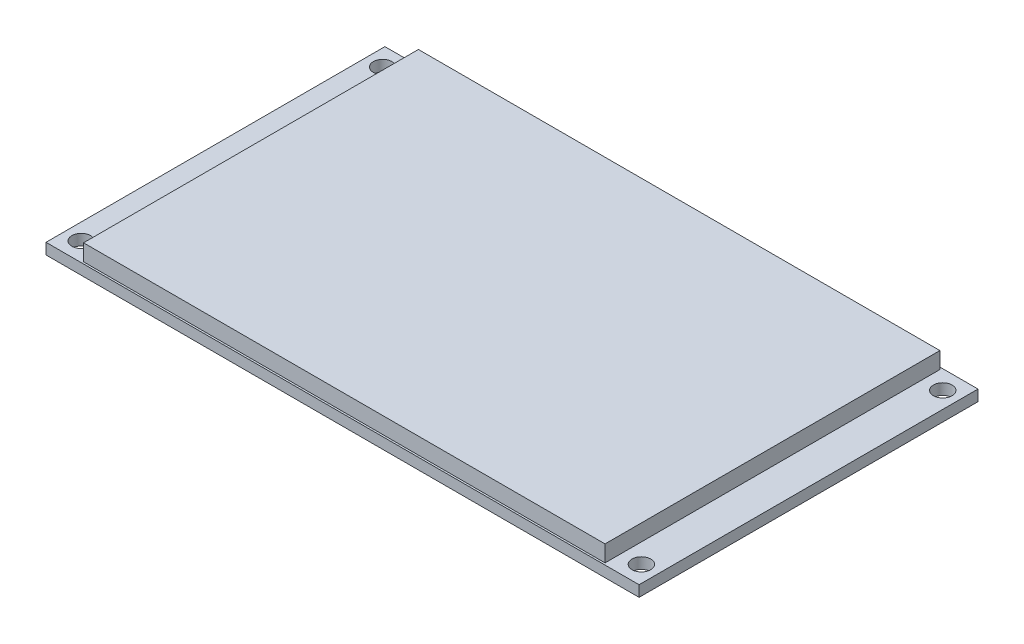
SolidWorks part; units mm, degrees
ref_plane "Piano frontale" through (0, 0, 0) normal (0, 0, 1) x (1, 0, 0)
ref_plane "Piano superiore" through (0, 0, 0) normal (0, 1, 0) x (1, 0, 0)
ref_plane "Piano destro" through (0, 0, 0) normal (1, 0, 0) x (0, 0, -1)
sketch "Schizzo2" plane through (0, 0, 0) normal (0, 1, 0) x (1, 0, 0)
  line L1 (-54.02, 30.87) -> (54.02, 30.87)
  line L2 (-54.02, 30.87) -> (-54.02, -30.87)
  line L3 (-54.02, -30.87) -> (54.02, -30.87)
  line L4 (54.02, 30.87) -> (54.02, -30.87)
  line L5 (-54.02, 30.87) -> (54.02, -30.87) construction
  line L6 (-54.02, -30.87) -> (54.02, 30.87) construction
  point P0 (0, 0)
  dimension "D1" = 108.04
  dimension "D2" = 61.74
extrude "Estrusione-Estrusione1" add sketch "Schizzo2" along normal blind 2
sketch "Schizzo3" plane through (0, 2, 0) normal (0, 1, 0) x (1, 0, 0)
  line L0 (54.02, -30.87) -> (54.02, 30.87) construction
  line L1 (-47.52, 30.47) -> (47.48, 30.47)
  line L2 (-47.52, 30.47) -> (-47.52, -30.53)
  line L3 (-47.52, -30.53) -> (47.48, -30.53)
  line L4 (47.48, 30.47) -> (47.48, -30.53)
  line L5 (-47.52, 30.47) -> (47.48, -30.53) construction
  line L6 (-47.52, -30.53) -> (47.48, 30.47) construction
  line L7 (54.02, 30.87) -> (-54.02, 30.87) construction
  point P0 (-0.02, -0.03)
  dimension "D1" = 95
  dimension "D2" = 6.54
  dimension "D3" = 61
  dimension "D4" = 0.4
extrude "Estrusione-Estrusione2" add sketch "Schizzo3" along normal blind 3
sketch "Schizzo6" plane through (0, 2, 0) normal (0, 1, 0) x (1, 0, 0)
  line L0 (-54.02, 30.87) -> (-54.02, -30.87) construction
  line L1 (-51.02, 27.45) -> (51.02, 27.45)
  line L2 (-51.02, 27.45) -> (-51.02, -27.45)
  line L3 (-51.02, -27.45) -> (51.02, -27.45)
  line L4 (51.02, 27.45) -> (51.02, -27.45)
  line L5 (-51.02, 27.45) -> (51.02, -27.45) construction
  line L6 (-51.02, -27.45) -> (51.02, 27.45) construction
  line L7 (-54.02, -30.87) -> (54.02, -30.87) construction
  point P0 (0, 0)
  dimension "D1" = 3
  dimension "D2" = 3.42
hole_wizard "Foro per Vite M3-2" positions "Schizzo7" profile "Schizzo8" hole size "M3" standard "ISO"
sketch "Schizzo7" plane through (0, 2, 0) normal (0, 1, 0) x (1, 0, 0)
  point P0 (-51.02, 27.45)
  point P3 (-51.02, -27.45)
  point P6 (51.02, 27.45)
  point P9 (51.02, -27.45)
sketch "Schizzo8" plane through (-51.02, 2, -27.45) normal (1, 0, 0) x (0, 0, 1)
  line L0 (0, 0) -> (0, 2)
  line L1 (0, 2) -> (1.7, 2)
  line L2 (1.7, 2) -> (1.7, 0)
  line L5 (1.7, 0) -> (0, 0)
  line L11 (0, -6.35) -> (0, 107.95) construction
  dimension "Thru Hole Dia." = 3.4
  dimension "Thru Hole Depth" = 2
